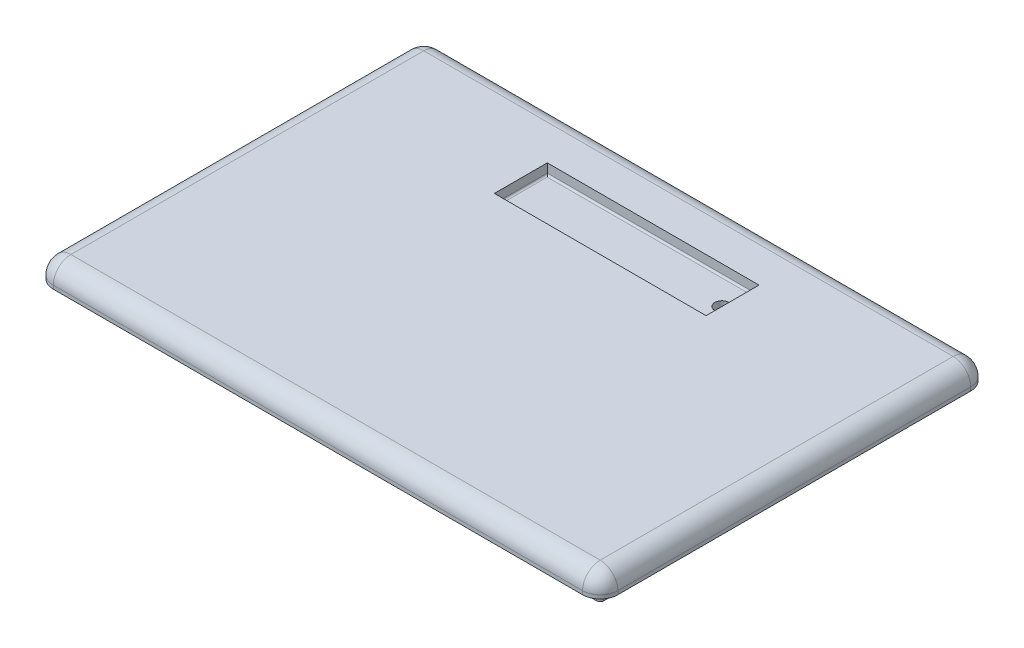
SolidWorks part; units mm, degrees
ref_plane "Front Plane" through (0, 0, 0) normal (0, 0, 1) x (1, 0, 0)
ref_plane "Top Plane" through (0, 0, 0) normal (0, 1, 0) x (1, 0, 0)
ref_plane "Right Plane" through (0, 0, 0) normal (1, 0, 0) x (0, 0, -1)
sketch "Sketch1" plane through (0, 0, 0) normal (0, 1, 0) x (1, 0, 0)
  line L1 (-80, 55) -> (80, 55)
  line L2 (-80, 55) -> (-80, -55)
  line L3 (-80, -55) -> (80, -55)
  line L4 (80, 55) -> (80, -55)
  line L5 (-80, 55) -> (80, -55) construction
  line L6 (-80, -55) -> (80, 55) construction
  point P0 (0, 0)
  dimension "D1" = 110
  dimension "D2" = 160
extrude "Boss-Extrude1" add sketch "Sketch1" along normal blind 6
fillet "Fillet1" radius 5 8 edges at (0, 6, 55) (-80, 6, 0) (0, 6, -55) (80, 6, 0) (-80, 3, 55) (80, 3, 55) (80, 3, -55) (-80, 3, -55)
sketch "Sketch2" plane through (0, 0, 0) normal (0, -1, 0) x (1, 0, 0)
  line L1 (-74.5, 49.5) -> (74.5, 49.5)
  line L2 (-74.5, 49.5) -> (-74.5, -49.5)
  line L3 (-74.5, -49.5) -> (74.5, -49.5)
  line L4 (74.5, 49.5) -> (74.5, -49.5)
  line L5 (-74.5, 49.5) -> (74.5, -49.5) construction
  line L6 (-74.5, -49.5) -> (74.5, 49.5) construction
  point P0 (0, 0)
  dimension "D1" = 99
  dimension "D2" = 149
extrude "Extrude-Thin1" add sketch "Sketch2" along normal blind 5 thin
fillet "Fillet2" radius 3 4 edges at (-69.5, 0, 0) (0, 0, 44.5) (69.5, 0, 0) (0, 0, -44.5)
fillet "Fillet3" radius 1 4 edges at (0, -5, -44.5) (69.5, -5, 0) (0, -5, 44.5) (-69.5, -5, 0)
sketch "Sketch3" plane through (-80, 0, 0) normal (-1, 0, 0) x (0, 0, 1)
  line L0 (-8, 0) -> (8, 0)
  line L1 (49.5, 0) -> (-49.5, 0) construction
  line L2 (-50, 0) -> (50, 0) construction
  line L4 (-5, 3) -> (5, 3)
  arc A1 (8, 0) -> (5, 3) centre (5, 0) ccw
  arc A2 (-8, 0) -> (-5, 3) centre (-5, 0) cw
  point P11 (0, 0)
  dimension "D2" = 3
  dimension "D1" = 3
  dimension "D3" = 16
  dimension "D4" = 10
revolve "Cut-Revolve1" cut sketch "Sketch3" angle 90 about L0
sketch "Sketch5" plane through (0, 6, 0) normal (0, 1, 0) x (1, 0, 0)
  line L0 (75, 50) -> (-75, 50) construction
  line L1 (-25, 40) -> (25, 40)
  line L2 (-25, 40) -> (-25, 25)
  line L3 (-25, 25) -> (25, 25)
  line L4 (25, 40) -> (25, 25)
  line L5 (-25, 40) -> (25, 25) construction
  line L6 (-25, 25) -> (25, 40) construction
  point P0 (0, 32.5)
  dimension "D1" = 50
  dimension "D2" = 15
  dimension "D3" = 10
extrude "Cut-Extrude1" cut sketch "Sketch5" against normal blind 3
fillet "Fillet4" radius 0.5 4 edges at (30, 3, -32.5) (0, 3, -25) (-30, 3, -32.5) (0, 3, -40)
sketch "Sketch6" plane through (0, 3, 0) normal (0, 1, 0) x (1, 0, 0)
  line L0 (30, 25) -> (30, 40) construction
  circle A0 centre (27, 32.5) radius 2
  point P4 (30, 32.5)
  dimension "D1" = 4
  dimension "D2" = 3
extrude "Cut-Extrude2" cut sketch "Sketch6" against normal blind 5
fillet "Fillet5" radius 1 4 edges at (74.5, -2.5, -49.5) (74.5, -2.5, 49.5) (-74.5, -2.5, 49.5) (-74.5, -2.5, -49.5)
